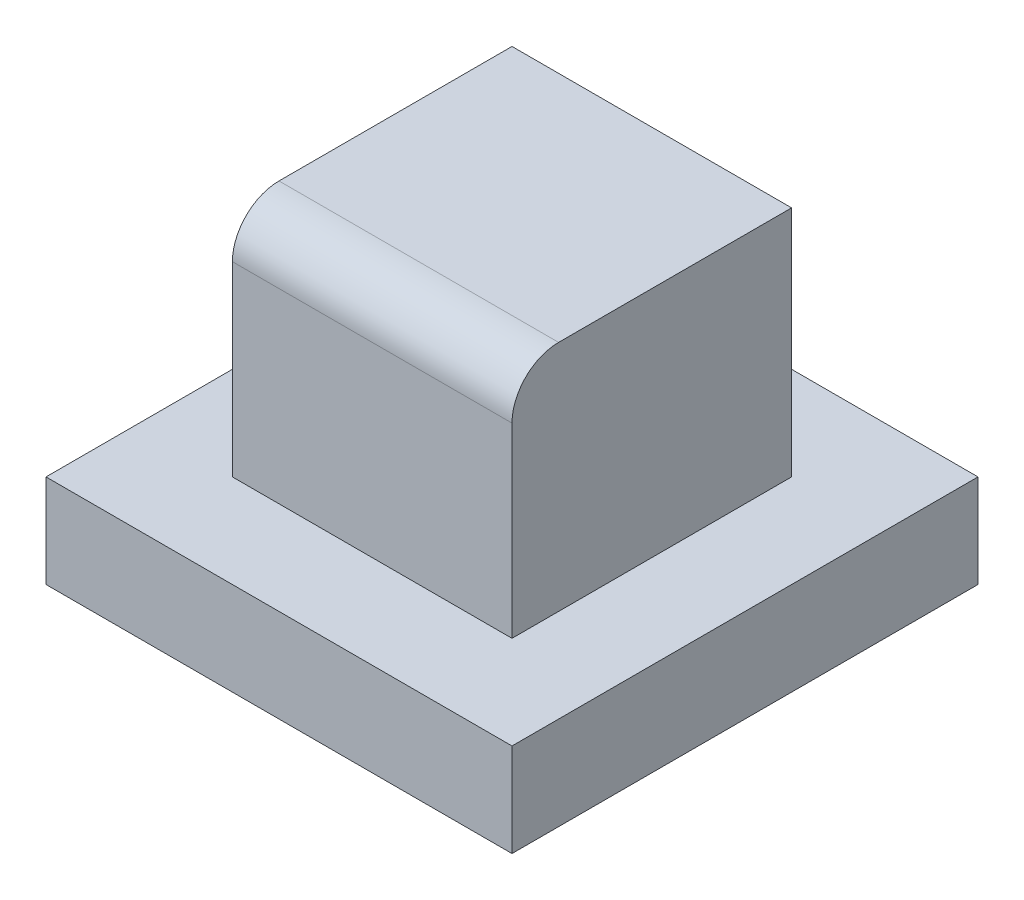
SolidWorks part; units mm, degrees
ref_plane "Front" through (0, 0, 0) normal (0, 0, 1) x (1, 0, 0)
ref_plane "Top" through (0, 0, 0) normal (0, 1, 0) x (1, 0, 0)
ref_plane "Right" through (0, 0, 0) normal (1, 0, 0) x (0, 0, -1)
sketch "Sketch1" plane through (0, 0, 0) normal (0, 0, 1) x (1, 0, 0)
  line L1 (-50, 20) -> (50, 20)
  line L2 (-50, 20) -> (-50, 0)
  line L3 (-50, 0) -> (50, 0)
  line L4 (50, 20) -> (50, 0)
  dimension "D1" = 20
  dimension "D2" = 100
extrude "Extrude1" add sketch "Sketch1" along normal mid plane 100
sketch "Sketch2" plane through (0, 20, 0) normal (0, 1, 0) x (-1, 0, 0)
  line L0 (30, -30) -> (-30, 30) construction
  line L1 (-30, 30) -> (30, 30)
  line L2 (-30, 30) -> (-30, -30)
  line L3 (-30, -30) -> (30, -30)
  line L4 (30, 30) -> (30, -30)
  dimension "D1" = 60
  dimension "D2" = 60
extrude "Extrude2" add sketch "Sketch2" along normal blind 50
fillet "Fillet1" radius 10 1 edges at (0, 70, 30)
